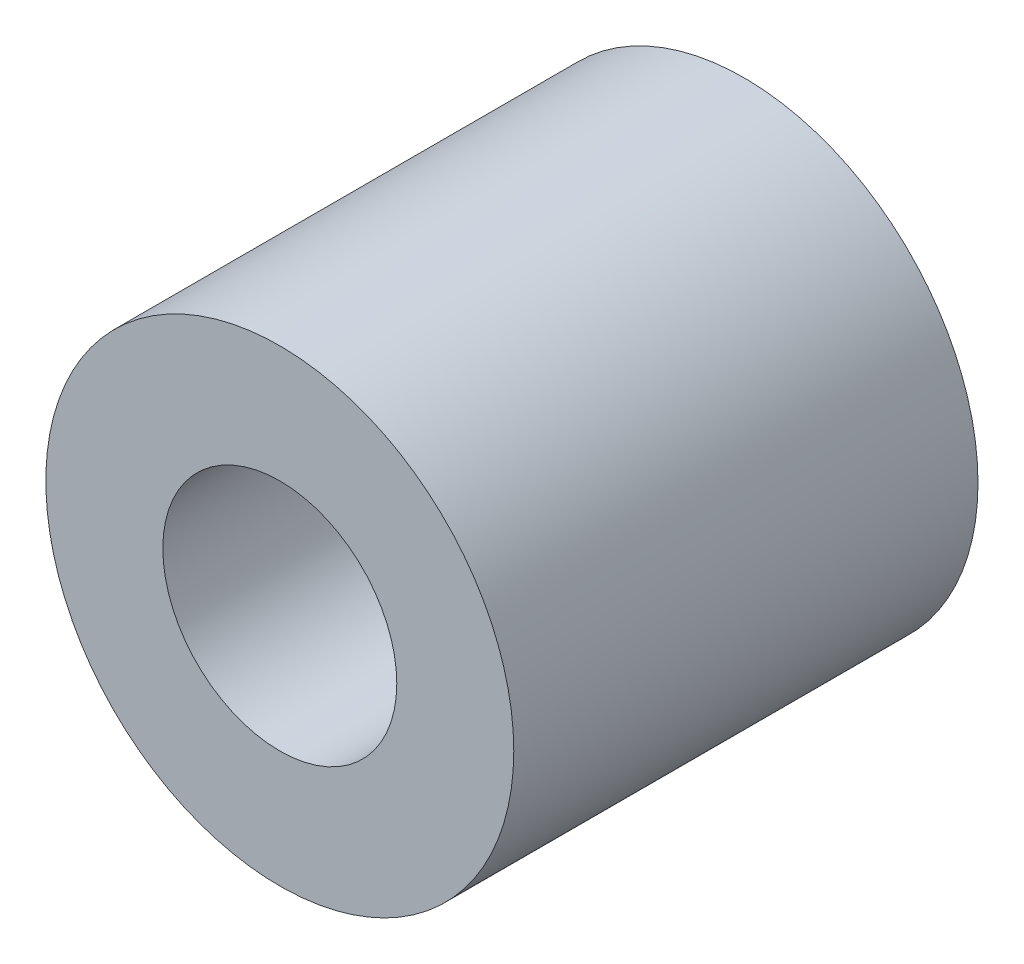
SolidWorks part; units mm, degrees
ref_plane "Front Plane" through (0, 0, 0) normal (0, 0, 1) x (1, 0, 0)
ref_plane "Top Plane" through (0, 0, 0) normal (0, 1, 0) x (1, 0, 0)
ref_plane "Right Plane" through (0, 0, 0) normal (1, 0, 0) x (0, 0, -1)
sketch "Sketch1" plane through (0, 0, 0) normal (0, 0, 1) x (1, 0, 0)
  circle A0 centre (0, 0) radius 3.2004
  circle A1 centre (0, 0) radius 1.6002
  dimension "D1" = 6.4008
  dimension "ID" = 3.2004
extrude "Extrude1" add sketch "Sketch1" along normal mid plane 6.35
sketch "Sketch2" plane through (0, 0, 0) normal (1, 0, 0) x (0, 0, -1)
  line L0 (-3.175, -1.6002) -> (3.175, -1.6002) construction
  line L3 (3.175, 1.6002) -> (-3.175, 1.6002) construction
  line L5 (-3.175, -1.6002) -> (3.175, -1.6002)
  line L6 (3.175, 1.6002) -> (-3.175, 1.6002)
sketch "Sketch4" plane through (0, 0, 3.175) normal (0, 0, 1) x (1, 0, 0)
  line L0 (0, 0) -> (-1.1315, 1.1315)
  line L1 (0, -13.97) -> (0, 13.97) construction
  circle A0 centre (0, 0) radius 1.6002 construction
  dimension "D1" = 45
